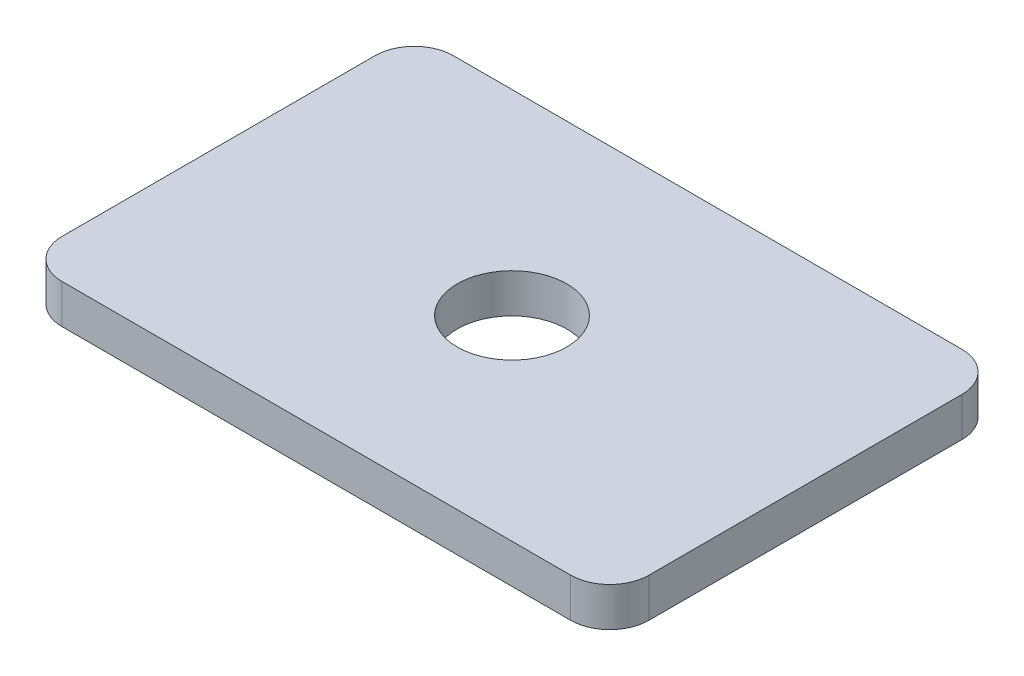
SolidWorks part; units mm, degrees
ref_plane "Front Plane" through (0, 0, 0) normal (0, 0, 1) x (1, 0, 0)
ref_plane "Top Plane" through (0, 0, 0) normal (0, 1, 0) x (1, 0, 0)
ref_plane "Right Plane" through (0, 0, 0) normal (1, 0, 0) x (0, 0, -1)
sketch "Sketch1" plane through (0, 0, 0) normal (0, 1, 0) x (1, 0, 0)
  line L0 (-37.5, 25) -> (37.5, -25) construction
  line L1 (-37.5, 25) -> (37.5, 25)
  line L2 (-37.5, 25) -> (-37.5, -25)
  line L3 (-37.5, -25) -> (37.5, -25)
  line L4 (37.5, 25) -> (37.5, -25)
  dimension "D1" = 75
  dimension "D2" = 50
extrude "Extrude1" add sketch "Sketch1" along normal blind 5
fillet "Fillet1" radius 5 4 edges at (37.5, 2.5, 25) (37.5, 2.5, -25) (-37.5, 2.5, -25) (-37.5, 2.5, 25)
sketch "Sketch4" plane through (0, 5, 0) normal (0, 1, 0) x (-1, 0, 0)
  circle A0 centre (0, 0) radius 7
  dimension "D1" = 14
extrude "Cut-Extrude2" cut sketch "Sketch4" against normal through all
